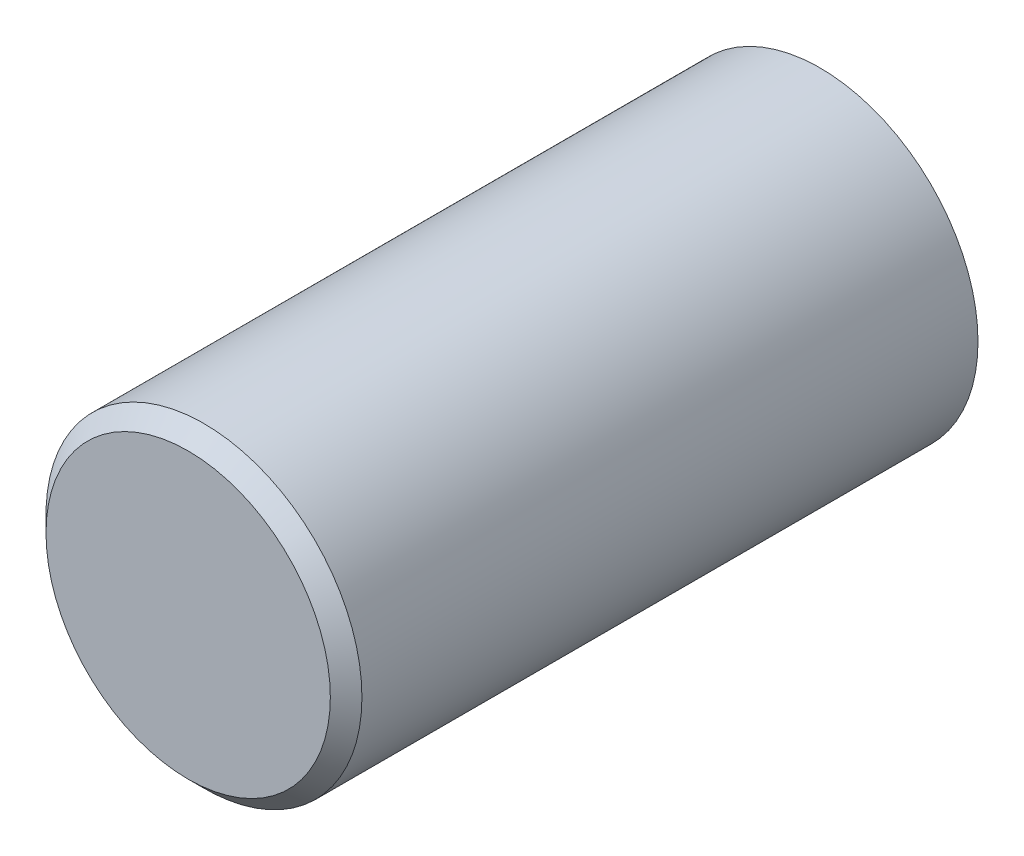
SolidWorks part; units mm, degrees
ref_plane "Plan de face" through (0, 0, 0) normal (0, 0, 1) x (1, 0, 0)
ref_plane "Plan de dessus" through (0, 0, 0) normal (0, 1, 0) x (1, 0, 0)
ref_plane "Plan de droite" through (0, 0, 0) normal (1, 0, 0) x (0, 0, -1)
sketch "Esquisse1" plane through (0, 0, 0) normal (0, 0, 1) x (1, 0, 0)
  circle A0 centre (0, 0) radius 10
  dimension "D1" = 20
extrude "Extrusion1" add sketch "Esquisse1" along normal blind 40
chamfer "Chanfrein1" distance 1 angle 45 1 edges at (10, 0, 40)
